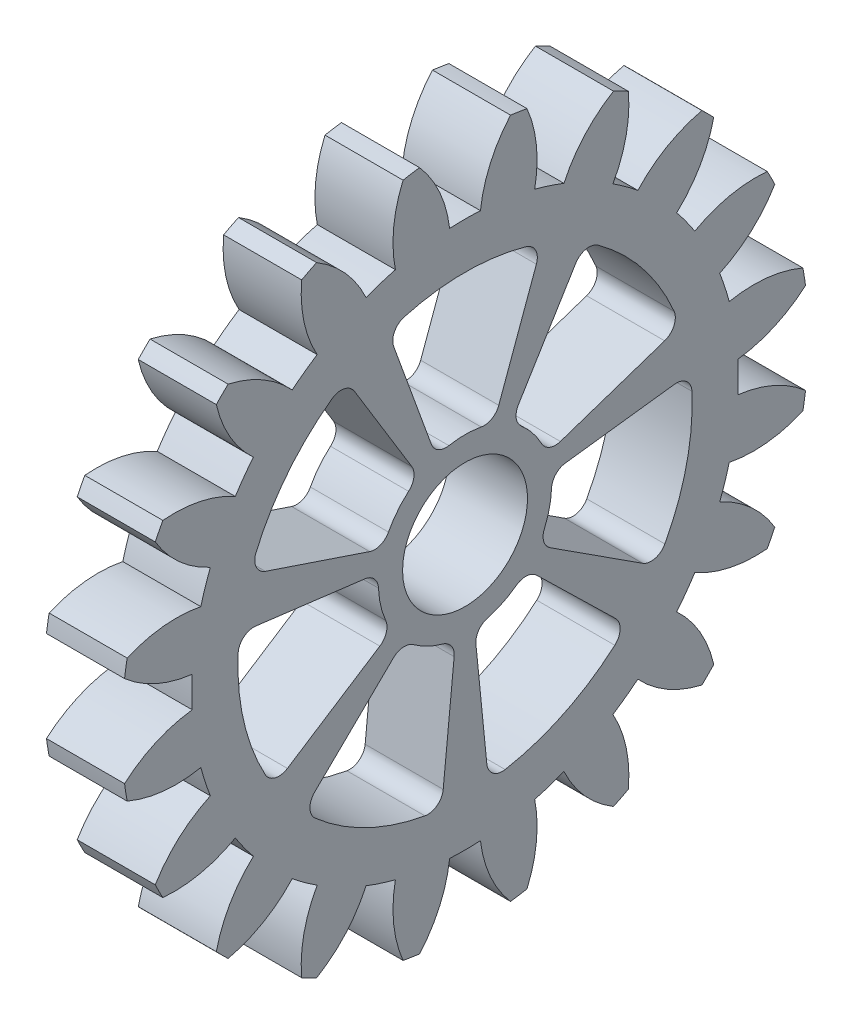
SolidWorks part; units mm, degrees
ref_plane "Plane1" through (0, 0, 0) normal (0, 0, 1) x (1, 0, 0)
ref_plane "Plane2" through (0, 0, 0) normal (0, 1, 0) x (1, 0, 0)
ref_plane "Plane3" through (0, 0, 0) normal (1, 0, 0) x (0, 0, -1)
sketch "HoldingSke" plane through (0, 0, 0) normal (0, 1, 0) x (1, 0, 0)
  line L0 (0, 0) -> (0.4698, -0.171)
  line L1 (-15, 0) -> (100, 0) construction
  line L2 (0, 0) -> (-2.1039, 2.3779)
  line L3 (0, 0) -> (-11.863, 4.5341)
  line L4 (0, 0) -> (8.1152, 2.9537)
  line L5 (0, 0) -> (-46.8476, -17.4728)
  line L6 (0, 0) -> (-4.1448, -2.7965)
  line L7 (-2.1039, 2.3779) -> (8.6586, 51.2059)
  line L8 (-76.2, 54.61) -> (-74.8, 54.61)
  line L9 (-71.009, 38.7566) -> (-53.1078, 45.2721)
  line L10 (-76.2, 71.12) -> (104.1128, 71.12)
  line L11 (0, 0) -> (-5, 0)
  line L12 (-76.2, 101.6) -> (-76.133, 101.6)
  line L13 (24.9733, 27.94) -> (52.9518, 28.4284)
  line L14 (24.9733, 27.94) -> (24.9743, 27.94)
  line L15 (24.9733, 27.94) -> (100.4006, 29.5858)
  line L16 (-63.627, -2) -> (-12.827, -2)
  circle A0 centre (0, 0) radius 4
  circle A1 centre (0, 0) radius 17.499
  circle A2 centre (0, 0) radius 37.5
  circle A3 centre (0, 0) radius 4
sketch "BasProSke" plane through (0, 0, 0) normal (0, 1, 0) x (1, 0, 0)
  line L0 (-10, 0) -> (60, 0) construction
  line L1 (0, 0) -> (0, 22)
  line L2 (0, 0) -> (5, 0)
  line L3 (5, 0) -> (5, 22)
  line L4 (5, 22) -> (0, 22)
revolve "Base-Revolve" add sketch "BasProSke" angle 360 about L0
sketch "TooCutSke" plane through (0, 0, 0) normal (1, 0, 0) x (0, 0, -1)
  line L1 (0, 0) -> (0, 107) construction
  line L2 (0, 0) -> (-1.6864, 19.9288) construction
  line L3 (0, 0) -> (-6.2409, 39.4033) construction
  line L4 (-1.6864, 19.9288) -> (-3.1204, 19.7016) construction
  arc A0 (0.9862, 17.4712) -> (-0.9862, 17.4712) centre (0, 0) ccw
  arc A1 (2.9329, 21.8293) -> (-2.9329, 21.8293) centre (0, 0) ccw
  circle A2 centre (0, 0) radius 20 construction
  circle A3 centre (0, 0) radius 18.7939 construction
  arc A4 (-0.9862, 17.4712) -> (-2.9329, 21.8293) centre (-8.9313, 16.536) ccw
  arc A5 (2.9329, 21.8293) -> (0.9862, 17.4712) centre (8.9313, 16.536) ccw
extrude "ToothCut" cut sketch "TooCutSke" along normal through all
fillet "Breaks" [suppressed] radius 0.04
fillet "RootFillets" [suppressed] radius 0.501
pattern_circular "TeethCuts" count 20 every 18 about axis through (-10, 0, 0) along (1, 0, 0) of "ToothCut", "RootFillets", "Breaks"
sketch "HubNeaOneSke" plane through (0, 0, 0) normal (-1, 0, 0) x (0, 0, 1)
  circle A0 centre (0, 0) radius 17.499
extrude "HubNearOne" [suppressed] add sketch "HubNeaOneSke" along normal blind 45.0001
sketch "HubNeaBotSke" plane through (0, 0, 0) normal (-1, 0, 0) x (0, 0, 1)
  circle A0 centre (0, 0) radius 17.499
extrude "HubNearBoth" [suppressed] add sketch "HubNeaBotSke" along normal blind 22.5
ref_plane "FarPln" through (5, 0, 0) normal (1, 0, 0) x (0, 0, -1)
sketch "HubFarSke" plane through (5, 0, 0) normal (1, 0, 0) x (0, 0, -1)
  circle A0 centre (0, 0) radius 17.499
extrude "HubFar" [suppressed] add sketch "HubFarSke" along normal blind 22.5
sketch "BorSke" plane through (0, 0, 0) normal (1, 0, 0) x (0, 0, -1)
  circle A0 centre (0, 0) radius 4
extrude "Bore" cut sketch "BorSke" along normal mid plane 100.0001
sketch "KeySke" plane through (0, 0, 0) normal (1, 0, 0) x (0, 0, -1)
  line L0 (-1.5, 0) -> (-1.5, 5.4)
  line L1 (-1.5, 5.4) -> (1.5, 5.4)
  line L2 (1.5, 5.4) -> (1.5, 0)
  line L3 (0, 0) -> (0, 34) construction
  line L4 (-1.5, 0) -> (1.5, 0)
extrude "Keyway" [suppressed] cut sketch "KeySke" along normal mid plane 100.0001
pattern_circular "Keyway2" [suppressed] count 2 every 90 about axis through (-10, 0, 0) along (1, 0, 0)
sketch "Esquisse1" plane through (5, 0, 0) normal (1, 0, 0) x (0, 0, -1)
  line L0 (0, 0) -> (0, 16.3935) construction
  line L1 (-4.569, 12.7102) -> (-2.1593, 6.0896)
  line L2 (4.569, 12.7102) -> (2.1593, 6.0896)
  line L3 (7.0885, 11.4969) -> (3.4147, 5.485)
  line L4 (12.786, 4.3524) -> (6.1073, 2.1086)
  line L5 (13.4082, 1.6262) -> (6.4174, 0.7501)
  line L6 (11.3748, -7.2828) -> (5.4564, -3.4603)
  line L7 (9.6313, -9.469) -> (4.5877, -4.5496)
  line L8 (1.3982, -13.4339) -> (0.6967, -6.4234)
  line L9 (-1.3982, -13.4339) -> (-0.6967, -6.4234)
  line L10 (-9.6313, -9.469) -> (-4.5877, -4.5496)
  line L11 (-11.3748, -7.2828) -> (-5.4564, -3.4603)
  line L12 (-13.4082, 1.6262) -> (-6.4174, 0.7501)
  line L13 (-12.786, 4.3524) -> (-6.1073, 2.1086)
  line L14 (-7.0885, 11.4969) -> (-3.4147, 5.485)
  arc A0 (3.8972, 14.0156) -> (-3.8972, 14.0156) centre (0, 0) ccw
  arc A1 (1.0333, 5.4491) -> (-1.0333, 5.4491) centre (0, 0) ccw
  arc A2 (-2.1593, 6.0896) -> (-1.0333, 5.4491) centre (-1.2196, 6.4316) ccw
  arc A3 (2.1593, 6.0896) -> (1.0333, 5.4491) centre (1.2196, 6.4316) cw
  arc A4 (4.569, 12.7102) -> (3.8972, 14.0156) centre (3.6293, 13.0522) ccw
  arc A5 (-4.569, 12.7102) -> (-3.8972, 14.0156) centre (-3.6293, 13.0522) cw
  arc A6 (13.3877, 5.6916) -> (8.528, 11.7856) centre (0, 0) ccw
  arc A7 (4.9045, 2.5896) -> (3.616, 4.2053) centre (0, 0) ccw
  arc A8 (3.4147, 5.485) -> (3.616, 4.2053) centre (4.268, 4.9636) ccw
  arc A9 (6.1073, 2.1086) -> (4.9045, 2.5896) centre (5.7889, 3.0565) cw
  arc A10 (12.786, 4.3524) -> (13.3877, 5.6916) centre (12.4675, 5.3004) ccw
  arc A11 (7.0885, 11.4969) -> (8.528, 11.7856) centre (7.9418, 10.9754) cw
  arc A12 (12.797, -6.9183) -> (14.5314, 0.6808) centre (0, 0) ccw
  arc A13 (5.0825, -2.22) -> (5.5424, -0.2051) centre (0, 0) ccw
  arc A14 (6.4174, 0.7501) -> (5.5424, -0.2051) centre (6.5417, -0.2421) ccw
  arc A15 (5.4564, -3.4603) -> (5.0825, -2.22) centre (5.9989, -2.6202) cw
  arc A16 (11.3748, -7.2828) -> (12.797, -6.9183) centre (11.9173, -6.4427) ccw
  arc A17 (13.4082, 1.6262) -> (14.5314, 0.6808) centre (13.5325, 0.634) cw
  arc A18 (2.5699, -14.3186) -> (9.5924, -10.9367) centre (0, 0) ccw
  arc A19 (1.4333, -5.3578) -> (3.2953, -4.4611) centre (0, 0) ccw
  arc A20 (4.5877, -4.5496) -> (3.2953, -4.4611) centre (3.8894, -5.2655) ccw
  arc A21 (0.6967, -6.4234) -> (1.4333, -5.3578) centre (1.6917, -6.3238) cw
  arc A22 (1.3982, -13.4339) -> (2.5699, -14.3186) centre (2.3932, -13.3343) ccw
  arc A23 (9.6313, -9.469) -> (9.5924, -10.9367) centre (8.9331, -10.1849) cw
  arc A24 (-9.5924, -10.9367) -> (-2.5699, -14.3186) centre (0, 0) ccw
  arc A25 (-3.2953, -4.4611) -> (-1.4333, -5.3578) centre (0, 0) ccw
  arc A26 (-0.6967, -6.4234) -> (-1.4333, -5.3578) centre (-1.6917, -6.3238) ccw
  arc A27 (-4.5877, -4.5496) -> (-3.2953, -4.4611) centre (-3.8894, -5.2655) cw
  arc A28 (-9.6313, -9.469) -> (-9.5924, -10.9367) centre (-8.9331, -10.1849) ccw
  arc A29 (-1.3982, -13.4339) -> (-2.5699, -14.3186) centre (-2.3932, -13.3343) cw
  arc A30 (-14.5314, 0.6808) -> (-12.797, -6.9183) centre (0, 0) ccw
  arc A31 (-5.5424, -0.2051) -> (-5.0825, -2.22) centre (0, 0) ccw
  arc A32 (-5.4564, -3.4603) -> (-5.0825, -2.22) centre (-5.9989, -2.6202) ccw
  arc A33 (-6.4174, 0.7501) -> (-5.5424, -0.2051) centre (-6.5417, -0.2421) cw
  arc A34 (-13.4082, 1.6262) -> (-14.5314, 0.6808) centre (-13.5325, 0.634) ccw
  arc A35 (-11.3748, -7.2828) -> (-12.797, -6.9183) centre (-11.9173, -6.4427) cw
  arc A36 (-8.528, 11.7856) -> (-13.3877, 5.6916) centre (0, 0) ccw
  arc A37 (-3.616, 4.2053) -> (-4.9045, 2.5896) centre (0, 0) ccw
  arc A38 (-6.1073, 2.1086) -> (-4.9045, 2.5896) centre (-5.7889, 3.0565) ccw
  arc A39 (-3.4147, 5.485) -> (-3.616, 4.2053) centre (-4.268, 4.9636) cw
  arc A40 (-7.0885, 11.4969) -> (-8.528, 11.7856) centre (-7.9418, 10.9754) ccw
  arc A41 (-12.786, 4.3524) -> (-13.3877, 5.6916) centre (-12.4675, 5.3004) cw
  point P15 (-1.2196, 6.4316)
  point P89 (0, 0)
  dimension "D2" = 1
  dimension "D1" = 40
  dimension "D3" = 7
extrude "Enlèv. mat.-Extru.1" cut sketch "Esquisse1" against normal blind 10
equation "' \"Module@HoldingSke\" = 6.35"
equation "' \"Num_teeth@HoldingSke\" = 12"
equation "' \"Ap@HoldingSke\" =  20"
equation "' \"Ap@HoldingSke\" = 20"
equation "' \"Width@HoldingSke\" = 0.5 * 25.4"
equation "' \"Hub_dia@HoldingSke\"= 1 * 25.4"
equation "' \"Hub_dia@HoldingSke\" = 1 * 25.4"
equation "' \"Overall_len@HoldingSke\" = 1.0 * 25.4"
equation "' \"Bore@HoldingSke\" = 0.75 * 25.4"
equation "' \"T_dim@HoldingSke\" = 0.1 * 25.4"
equation "' \"Width@KeySke\" = 0.25 * 25.4"
equation "' \"Show_teeth@HoldingSke\" = 13"
equation "' \"Backlash@HoldingSke\" = 0.009 * 25.4"
equation "' \"Addendum_fac@HoldingSke\" = 1.0"
equation "' \"Dedendum_fac@HoldingSke\" = 1.25"
equation "' \"Dedendum_add@HoldingSke\" = 0.00005 * 25.4"
equation "' \"Clearance_fac@HoldingSke\" = 0.25"
equation "\"Pitch@HoldingSke\" = 1 / \"Module@HoldingSke\""
equation "\"Overcut_dia@TooCutSke\" = (\"Num_teeth@HoldingSke\" + 2 * \"Addendum_fac@HoldingSke\") / \"Pitch@HoldingSke\" + 0.002 * 25.4"
equation "\"Pitch_dia@TooCutSke\" = \"Num_teeth@HoldingSke\" / \"Pitch@HoldingSke\""
equation "\"Base_dia@TooCutSke\" = \"Num_teeth@HoldingSke\" / \"Pitch@HoldingSke\" * cos((\"Ap@HoldingSke\"  * 3.14159265 / 180))"
equation "\"Root_dia@TooCutSke\" = (\"Num_teeth@HoldingSke\" + 2) / \"Pitch@HoldingSke\" - 2 * (\"Addendum_fac@HoldingSke\" + \"Dedendum_fac@HoldingSke\") / \"Pitch@HoldingSke\" - \"Dedendum_add@HoldingSke\" * 2"
equation "\"Half_ang@TooCutSke\" = 180 / \"Num_teeth@HoldingSke\""
equation "\"Half_CT@TooCutSke\" = \"Num_teeth@HoldingSke\" / \"Pitch@HoldingSke\" * sin((3.14159265 / 2 / \"Num_teeth@HoldingSke\")) / 2 - 7 * \"Backlash@HoldingSke\" / 4"
equation "\"Flank_rad@TooCutSke\" = \"Num_teeth@HoldingSke\" / \"Pitch@HoldingSke\" / 5"
equation "\"Radius@RootFillets\" = \"Clearance_fac@HoldingSke\" / \"Pitch@HoldingSke\" + \"Dedendum_add@HoldingSke\""
equation "\"Break_rad@Breaks\" = 0.02 / \"Pitch@HoldingSke\""
equation "\"Thickness@HoldingSke\" = \"Width@HoldingSke\""
equation "\"OAL@HoldingSke\" = \"Thickness@HoldingSke\""
equation "\"MHD@HoldingSke\" = (\"Num_teeth@HoldingSke\" + 2) / \"Pitch@HoldingSke\" - 2 * (\"Addendum_fac@HoldingSke\" + \"Dedendum_fac@HoldingSke\")  / \"Pitch@HoldingSke\" - \"Dedendum_add@HoldingSke\" * 2"
equation "\"MBD@HoldingSke\" = (\"Num_teeth@HoldingSke\" + 2) / \"Pitch@HoldingSke\" - 2 * (\"Addendum_fac@HoldingSke\" + \"Dedendum_fac@HoldingSke\")  / \"Pitch@HoldingSke\" - \"Dedendum_add@HoldingSke\" * 2 - 0.002 * 25.4"
equation "\"MHD@HoldingSke\" = ((sgn( \"MHD@HoldingSke\" - \"Hub_dia@HoldingSke\" )-1)*( \"MHD@HoldingSke\" - \"Hub_dia@HoldingSke\" ))/-2+ \"Hub_dia@HoldingSke\""
equation "\"MBD@HoldingSke\" = ((sgn( \"MBD@HoldingSke\" - \"Bore@HoldingSke\" )-1)*( \"MBD@HoldingSke\" - \"Bore@HoldingSke\" ))/-2+ \"Bore@HoldingSke\""
equation "\"OAL@HoldingSke\" = ((sgn( \"OAL@HoldingSke\" - \"Overall_len@HoldingSke\" )+1)*( \"OAL@HoldingSke\" - \"Overall_len@HoldingSke\" ))/2 + \"Overall_len@HoldingSke\" + 0.000002 * 25.4"
equation "\"Num_teeth@TeethCuts\" = int( \"Show_teeth@HoldingSke\" ) + 1"
equation "\"Num_teeth@TeethCuts\" = ((sgn( \"Num_teeth@TeethCuts\" - \"Num_teeth@HoldingSke\" )-1)*( \"Num_teeth@TeethCuts\" - \"Num_teeth@HoldingSke\" ))/-2+ \"Num_teeth@HoldingSke\""
equation "\"Num_teeth@TeethCuts\" = ((sgn( \"Num_teeth@TeethCuts\" - 2.0)+1)*( \"Num_teeth@TeethCuts\" - 2.0))/2 +2.0"
equation "\"Angle@TeethCuts\" = 360.0 / \"Num_teeth@HoldingSke\""
equation "\"Diameter@BasProSke\" = (\"Num_teeth@HoldingSke\" + 2 * \"Addendum_fac@HoldingSke\") / \"Pitch@HoldingSke\""
equation "\"Thickness@BasProSke\"  = \"Thickness@HoldingSke\""
equation "' \"Fillet_rad@BasProSke\" =  \"Thickness@HoldingSke\" * 0.05"
equation "' \"Fillet_rad@BasProSke\" = \"Thickness@HoldingSke\" * 0.05"
equation "\"MHD@HoldingSke\" = ((sgn( \"MHD@HoldingSke\" - \"Root_dia@TooCutSke\" )-1)*( \"MHD@HoldingSke\" - \"Root_dia@TooCutSke\" ))/-2+ \"Root_dia@TooCutSke\""
equation "\"Diameter@HubNeaOneSke\" = \"MHD@HoldingSke\""
equation "\"Length@HubNearOne\" = \"OAL@HoldingSke\" - \"Thickness@BasProSke\""
equation "\"Diameter@HubNeaBotSke\" = \"MHD@HoldingSke\""
equation "\"Length@HubNearBoth\" = ( \"OAL@HoldingSke\" - \"Thickness@BasProSke\" ) / 2.0"
equation "\"Thickness@FarPln\" = \"Thickness@BasProSke\""
equation "\"Diameter@HubFarSke\" = \"MHD@HoldingSke\""
equation "\"Length@HubFar\" = ( \"OAL@HoldingSke\" - \"Thickness@BasProSke\" ) / 2.0"
equation "\"Diameter@BorSke\" = \"MBD@HoldingSke\""
equation "\"D1@Bore\" = \"OAL@HoldingSke\" * 2.0"
equation "\"D1@Keyway\" = \"OAL@HoldingSke\" * 2.0"
equation "\"Offset@KeySke\" = \"T_dim@HoldingSke\" + \"MBD@HoldingSke\" / 2.0"
